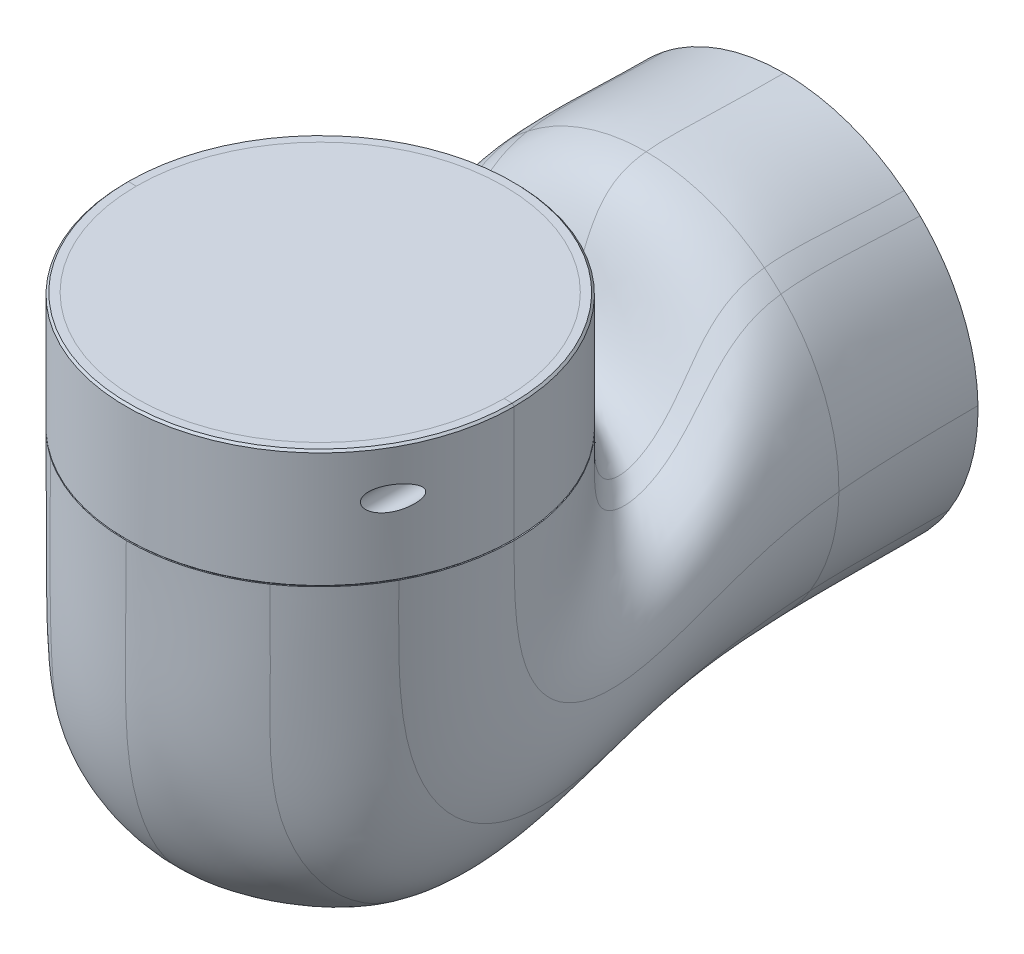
SolidWorks part; units mm, degrees
ref_plane "前视基准面" through (0, 0, 0) normal (0, 0, 1) x (1, 0, 0)
ref_plane "上视基准面" through (0, 0, 0) normal (0, 1, 0) x (1, 0, 0)
ref_plane "右视基准面" through (0, 0, 0) normal (1, 0, 0) x (0, 0, -1)
imported_body "消除特征1"
ref_plane "基准面1" through (0, -10.5607, 0) normal (0, 1, 0) x (1, 0, 0)
split "分割1" trim tools "基准面1" bodies to split 106 resulting bodies 107 108
